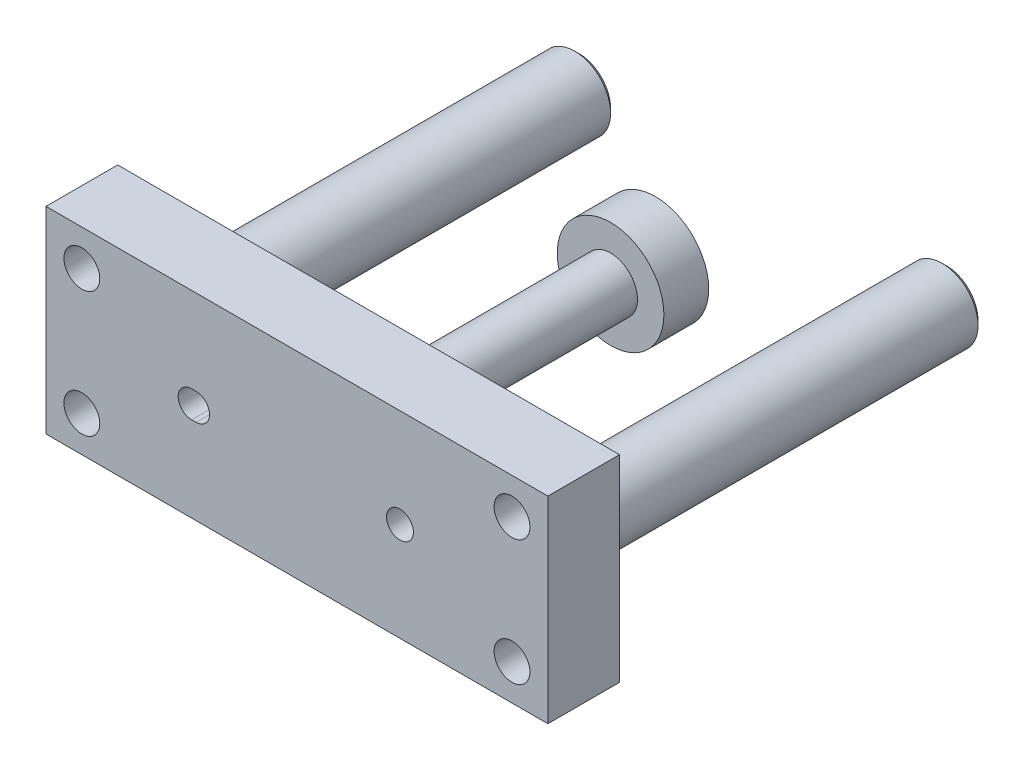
SolidWorks part; units mm, degrees
ref_plane "Plane1" through (0, 0, 0) normal (0, 0, 1) x (1, 0, 0)
ref_plane "Plane2" through (0, 0, 0) normal (0, 1, 0) x (1, 0, 0)
ref_plane "Plane3" through (0, 0, 0) normal (1, 0, 0) x (0, 0, -1)
sketch "Sketch1" plane through (0, 0, 0) normal (0, 0, 1) x (1, 0, 0)
  circle A0 centre (0, 0) radius 5.95
  dimension "D1" = 11.9
extrude "Piston" add sketch "Sketch1" along normal mid plane 5
sketch "Sketch2" plane through (0, 0, 0) normal (0, 0, 1) x (1, 0, 0)
  circle A0 centre (0, 0) radius 3
  dimension "D1" = 6
extrude "Rod" add sketch "Sketch2" along normal up to surface (29.5 mm away)
sketch "Sketch3" plane through (0, 0, 29.5) normal (0, 0, 1) x (1, 0, 0)
  line L0 (0, 0) -> (0, 3.9556) construction
  line L1 (-28, 11) -> (28, 11)
  line L2 (-28, 11) -> (-28, -11)
  line L3 (-28, -11) -> (28, -11)
  line L4 (28, 11) -> (28, -11)
  line L5 (0, 0) -> (3.9556, 0) construction
  dimension "D1" = 56
  dimension "D2" = 22
extrude "Plate" add sketch "Sketch3" along normal blind 8
sketch "Sketch4" plane through (0, 0, 29.5) normal (0, 0, -1) x (-1, 0, 0)
  line L0 (0, 0) -> (0, 19.638) construction
  circle A0 centre (-20.5, 0) radius 4
  circle A1 centre (20.5, 0) radius 4
  dimension "D1" = 8
  dimension "D2" = 41
extrude "Guides" add sketch "Sketch4" along normal up to surface (44 mm away)
sketch "Sketch5" plane through (0, 0, 37.5) normal (0, 0, 1) x (1, 0, 0)
  line L0 (0, 0) -> (0, 47.1532) construction
  circle A0 centre (11.5, 0) radius 1.5
  circle A1 centre (-11.5, 0) radius 1.5
  dimension "XA" = 3
  dimension "X" = 23
extrude "Position Holes" cut sketch "Sketch5" against normal blind 6
sketch "Sketch8" plane through (0, 0, 37.5) normal (0, 0, 1) x (1, 0, 0)
  line L0 (-11.5, 0) -> (-8.4413, 0) construction
  line L1 (-11.75, 0) -> (-11.25, 0) construction
  line L2 (-11.75, 1.5) -> (-11.25, 1.5)
  line L3 (-11.75, -1.5) -> (-11.25, -1.5)
  arc A0 (-11.25, -1.5) -> (-11.25, 1.5) centre (-11.25, 0) ccw
  arc A1 (-11.75, 1.5) -> (-11.75, -1.5) centre (-11.75, 0) ccw
  dimension "XA" = 3
  dimension "XB" = 3.5
extrude "Oblong Position Hole" cut sketch "Sketch8" against normal blind 3
chamfer "Chamfer1" distance 0.5 angle 45 2 edges at (16.5, 0, -14.5) (-24.5, 0, -14.5)
sketch "Sketch6" plane through (0, 0, 37.5) normal (0, 0, 1) x (1, 0, 0)
  line L0 (0, 0) -> (0, 55.313) construction
  line L1 (0, 0) -> (60.9143, 0) construction
  circle A0 centre (24, 7) radius 2
  circle A1 centre (-24, 7) radius 2
  circle A2 centre (24, -7) radius 2
  circle A3 centre (-24, -7) radius 2
  dimension "D1" = 4
  dimension "D2" = 48
  dimension "D3" = 14
  dimension "D4" = 7
extrude "MountHoles2" cut sketch "Sketch6" against normal through all
